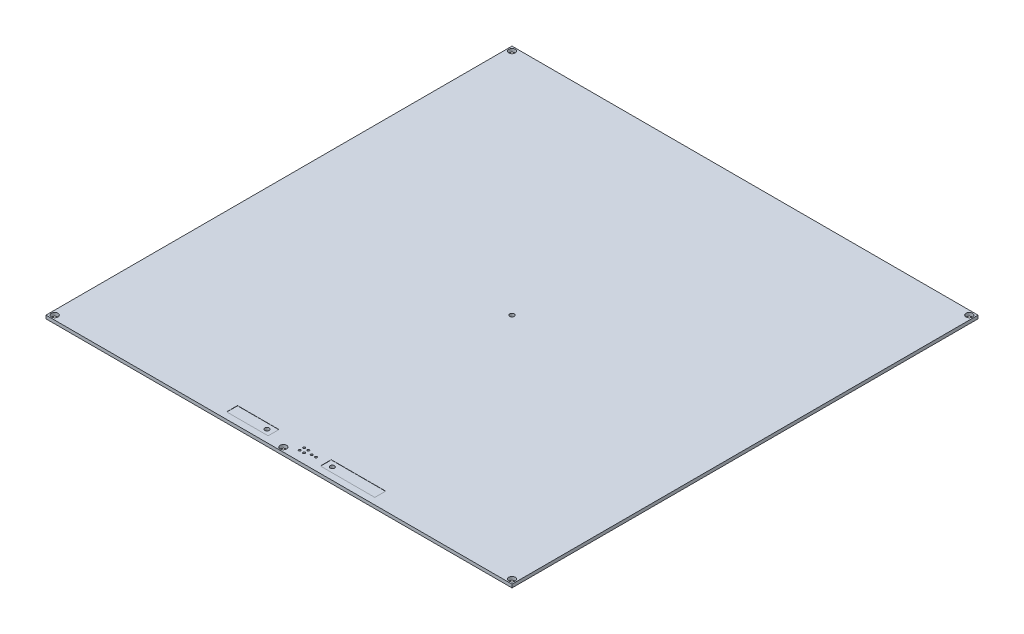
SolidWorks part; units mm, degrees
ref_plane "Ebene vorne" through (0, 0, 0) normal (0, 0, 1) x (1, 0, 0)
ref_plane "Ebene oben" through (0, 0, 0) normal (0, 1, 0) x (1, 0, 0)
ref_plane "Ebene rechts" through (0, 0, 0) normal (1, 0, 0) x (0, 0, -1)
sketch "Skizze1" plane through (0, 0, 0) normal (0, 1, 0) x (1, 0, 0)
  line L1 (107, 107) -> (-107, 107)
  line L2 (107, 107) -> (107, -107)
  line L3 (107, -107) -> (-107, -107)
  line L4 (-107, 107) -> (-107, -107)
  line L5 (107, 107) -> (-107, -107) construction
  line L6 (107, -107) -> (-107, 107) construction
  point P0 (0, 0)
  dimension "D1" = 214
  dimension "D2" = 214
extrude "Aufsatz-Linear austragen1" add sketch "Skizze1" along normal blind 1.5
sketch "Skizze2" plane through (0, 1.5, 0) normal (0, 1, 0) x (1, 0, 0)
  line L0 (-107, 107) -> (-107, -107) construction
  line L1 (107, 107) -> (-107, 107) construction
  circle A0 centre (-105, 105) radius 1.5
  dimension "D1" = 3
  dimension "D2" = 2
  dimension "D3" = 2
extrude "Schnitt-Linear austragen1" cut sketch "Skizze2" against normal through all
mirror "Spiegeln1" about plane through (0, 0, 0) normal (0, 0, 1) of "Schnitt-Linear austragen1"
mirror "Spiegeln2" about plane through (0, 0, 0) normal (1, 0, 0) of "Spiegeln1", "Schnitt-Linear austragen1"
sketch "Skizze3" plane through (0, 1.5, 0) normal (0, 1, 0) x (1, 0, 0)
  line L0 (0, -107) -> (0, -105) construction
  line L1 (-107, -107) -> (107, -107) construction
  line L2 (7, -100.5) -> (7, -102.5) construction
  line L3 (7, -101.5) -> (9.5, -101.5) construction
  circle A0 centre (0, -105) radius 1.5
  circle A1 centre (-11, -101.5) radius 1
  circle A2 centre (19, -101.5) radius 1
  circle A3 centre (5, -100.5) radius 0.5
  circle A4 centre (5, -102.5) radius 0.5
  circle A5 centre (7, -100.5) radius 0.5
  circle A6 centre (7, -102.5) radius 0.5
  circle A7 centre (9.5, -101.5) radius 0.5
  circle A8 centre (11.5, -101.5) radius 0.5
  circle A9 centre (0, 0) radius 1.05
  dimension "D1" = 3
  dimension "D4" = 2
  dimension "D6" = 1
  dimension "D13" = 2.1
  dimension "D2" = 30
  dimension "D3" = 2
  dimension "D5" = 5.5
  dimension "D7" = 2
  dimension "D8" = 2
  dimension "D9" = 2
  dimension "D10" = 2.5
  dimension "D11" = 5
  dimension "D12" = 4.5
  dimension "D14" = 11
extrude "Schnitt-Linear austragen2" cut sketch "Skizze3" against normal through all
sketch "Skizze4" plane through (0, 1.5, 0) normal (0, 1, 0) x (1, 0, 0)
  line L0 (-11, -101.5) -> (-8, -101.5) construction
  line L1 (-27.0506, -99) -> (-8, -99)
  line L2 (-27.0506, -99) -> (-27.0506, -104)
  line L3 (-27.0506, -104) -> (-8, -104)
  line L4 (-8, -99) -> (-8, -104)
  line L5 (16, -99) -> (41, -99)
  line L6 (16, -99) -> (16, -104)
  line L7 (16, -104) -> (41, -104)
  line L8 (41, -99) -> (41, -104)
  line L9 (19, -101.5) -> (16, -101.5) construction
  dimension "D1" = 3
  dimension "D2" = 5
  dimension "D3" = 25
extrude "Schnitt-Linear austragen3" cut sketch "Skizze4" against normal blind 0.1
